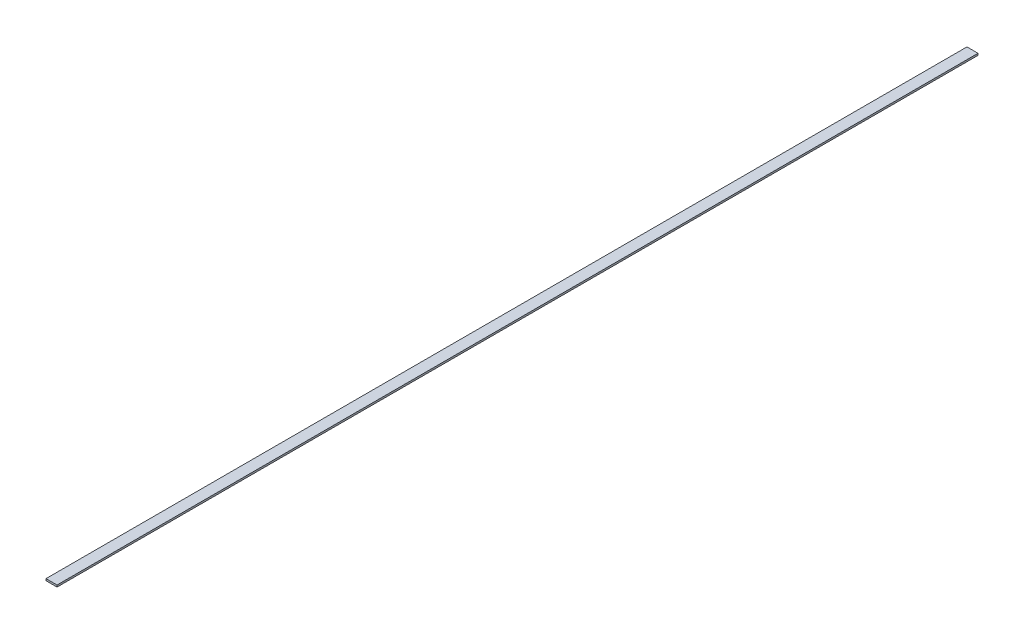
SolidWorks part; units mm, degrees
ref_plane "Front Plane" through (0, 0, 0) normal (0, 0, 1) x (1, 0, 0)
ref_plane "Top Plane" through (0, 0, 0) normal (0, 1, 0) x (1, 0, 0)
ref_plane "Right Plane" through (0, 0, 0) normal (1, 0, 0) x (0, 0, -1)
sketch "Sketch1" plane through (0, 0, 0) normal (0, 0, 1) x (1, 0, 0)
  line L1 (-14, 9.0984) -> (-2, 9.0984)
  line L2 (-14, 9.0984) -> (-14, 7.0984)
  line L3 (-14, 7.0984) -> (-2, 7.0984)
  line L4 (-2, 9.0984) -> (-2, 7.0984)
  dimension "D1" = 12
  dimension "D2" = 2
extrude "Boss-Extrude1" add sketch "Sketch1" along normal blind 1000
